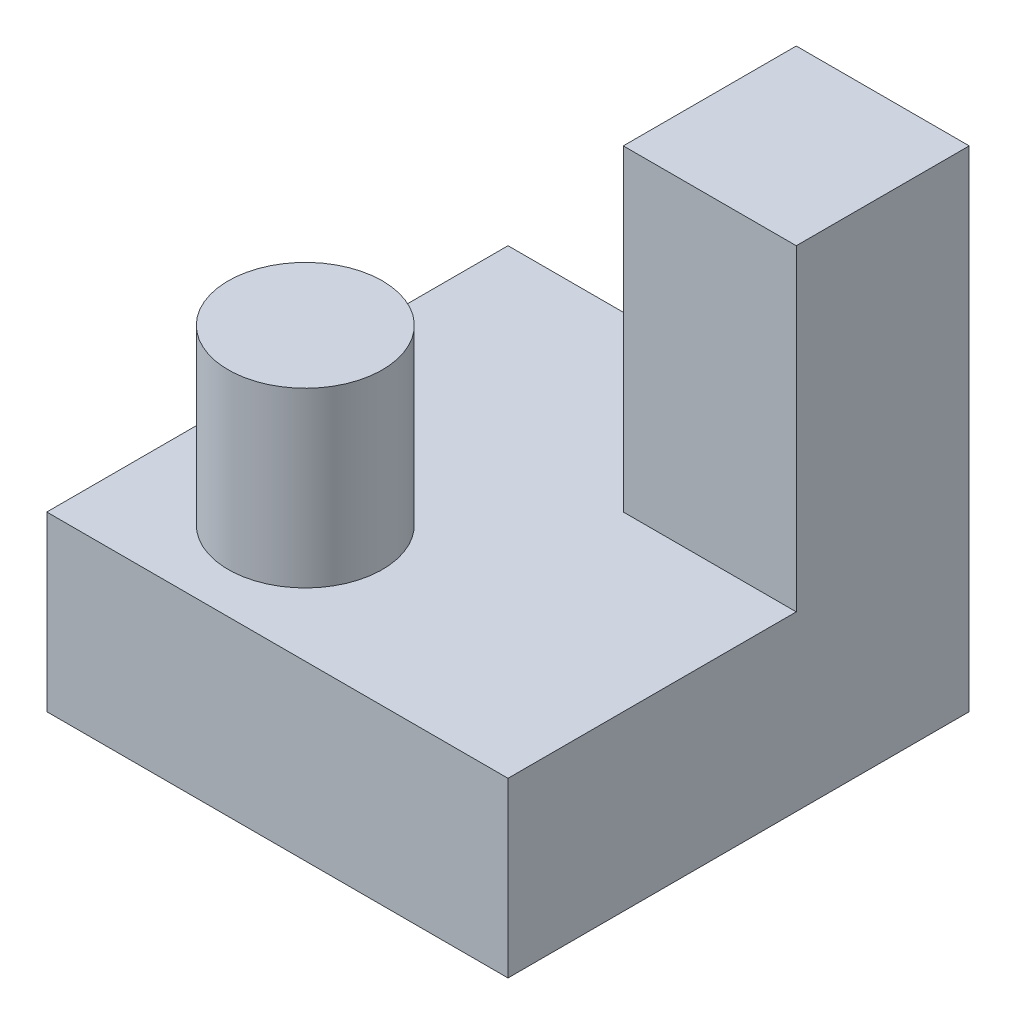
SolidWorks part; units mm, degrees
ref_plane "Front Plane" through (0, 0, 0) normal (0, 0, 1) x (1, 0, 0)
ref_plane "Top Plane" through (0, 0, 0) normal (0, 1, 0) x (1, 0, 0)
ref_plane "Right Plane" through (0, 0, 0) normal (1, 0, 0) x (0, 0, -1)
sketch "Sketch1" plane through (0, 0, 0) normal (0, 1, 0) x (1, 0, 0)
  line L1 (0, 0) -> (101.6, 0)
  line L2 (0, 0) -> (0, 101.6)
  line L3 (0, 101.6) -> (101.6, 101.6)
  line L4 (101.6, 0) -> (101.6, 101.6)
  dimension "D1" = 101.6
  dimension "D2" = 101.6
extrude "Extrude1" add sketch "Sketch1" along normal blind 38.1
sketch "Sketch3" plane through (0, 38.1, 0) normal (0, 1, 0) x (1, 0, 0)
  circle A0 centre (30.9636, 25.9877) radius 16.984
sketch "Sketch4" plane through (0, 38.1, 0) normal (0, 1, 0) x (1, 0, 0)
  line L0 (101.6, 101.6) -> (0, 101.6) construction
  line L1 (101.6, 101.6) -> (63.5, 101.6)
  line L2 (101.6, 101.6) -> (101.6, 63.5)
  line L3 (101.6, 63.5) -> (63.5, 63.5)
  line L4 (63.5, 101.6) -> (63.5, 63.5)
  line L5 (101.6, 0) -> (101.6, 101.6) construction
  dimension "D1" = 38.1
  dimension "D2" = 38.1
extrude "Extrude2" add sketch "Sketch3" along normal blind 38.1
extrude "Extrude3" add sketch "Sketch4" along normal blind 69.85
